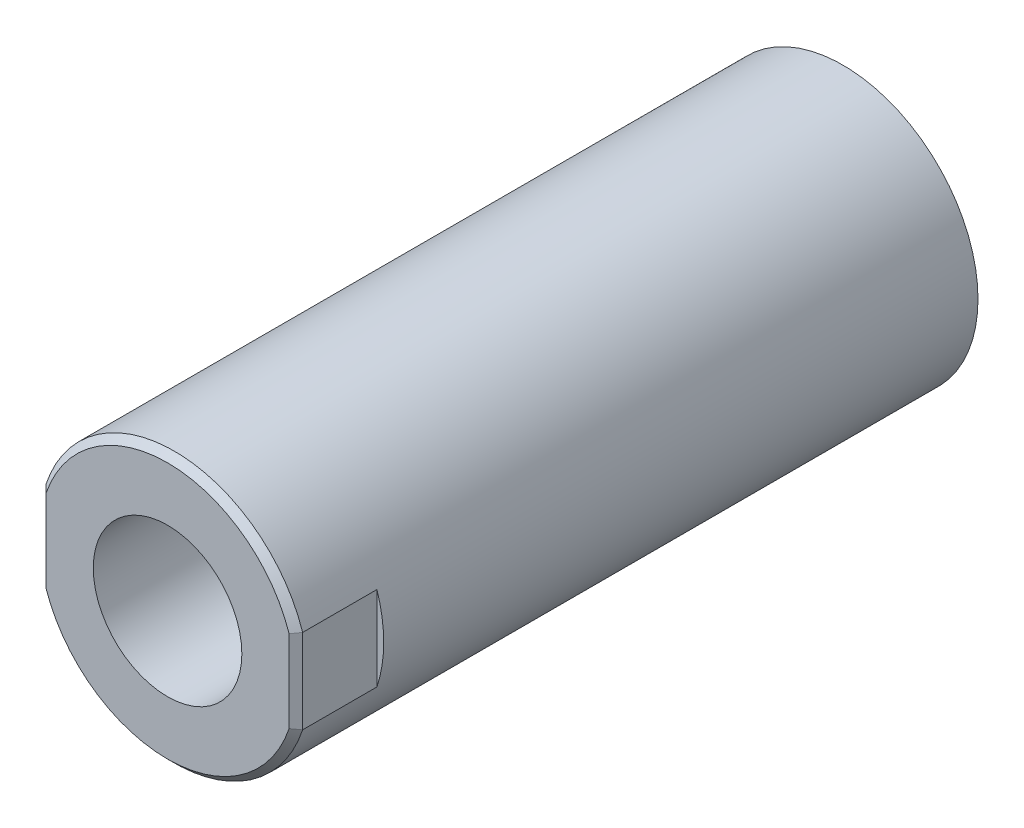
SolidWorks part; units mm, degrees
ref_plane "Front Plane" through (0, 0, 0) normal (0, 0, 1) x (1, 0, 0)
ref_plane "Top Plane" through (0, 0, 0) normal (0, 1, 0) x (1, 0, 0)
ref_plane "Right Plane" through (0, 0, 0) normal (1, 0, 0) x (0, 0, -1)
sketch "Sketch1" plane through (0, 0, 0) normal (0, 0, 1) x (1, 0, 0)
  circle A0 centre (0, 0) radius 20
  dimension "D1" = 40
extrude "S" add sketch "Sketch1" against normal blind 100
sketch "Sketch2" plane through (0, 0, 0) normal (0, 0, 1) x (1, 0, 0)
  circle A0 centre (0, 0) radius 20
  circle A1 centre (0, 0) radius 20 construction
  dimension "D1" = 40
extrude "L2" add sketch "Sketch2" along normal blind 15
hole_wizard "( T1xL4 ) M16x1.25 Tapped Hole1 " positions "3DSketch1" profile "Sketch5" tap size "M24x2.0" standard "Ansi Metric"
sketch3d "3DSketch1"
  circle A0 centre (0, 0, 15) radius 20 construction
  point P0 (0, 0, 15)
  point P5 (0, 0, 35)
sketch "Sketch5" plane through (0, 0, 15) normal (1, 0, 0) x (0, -1, 0)
  line L0 (0, 0) -> (0, 60.6095)
  line L1 (0, 60.6095) -> (11, 54)
  line L2 (11, 54) -> (11, 0)
  line L5 (11, 0) -> (0, 0)
  line L10 (0, 60.6095) -> (-11, 54) construction
  line L11 (0, -6.35) -> (0, 107.95) construction
  dimension "Tap Drill Dia." = 22
  dimension "Tap Drill Depth" = 54
  dimension "Drill Angle" = 118
chamfer "Chamfer2" distance 0.5 angle 45 1 edges at (20, 0, 15)
sketch "Sketch6" plane through (0, 0, 0) normal (0, 0, 1) x (1, 0, 0)
  circle A0 centre (0, 0) radius 19.5
  circle A1 centre (0, 0) radius 20
  circle A2 centre (0, 0) radius 20 construction
  circle A4 centre (0, 0) radius 20 construction
  dimension "D1" = 40
  dimension "D2" = 39
  dimension "D3" = 40
extrude "U/C" cut sketch "Sketch6" along normal blind 1
sketch "Sketch7" plane through (0, 0, 0) normal (0, 1, 0) x (1, 0, 0)
  line L1 (19, 0) -> (21.5, 0)
  line L2 (19, 0) -> (19, 12)
  line L3 (19, 12) -> (21.5, 12)
  line L4 (21.5, 0) -> (21.5, 12)
  line L5 (-21.5, 0) -> (-19, 0)
  line L6 (-21.5, 0) -> (-21.5, 12)
  line L7 (-21.5, 12) -> (-19, 12)
  line L8 (-19, 0) -> (-19, 12)
  line L12 (0, -1) -> (0, -14.5) construction
  line L13 (-20, 100) -> (20, 100) construction
  line L14 (0, 0) -> (0, -15) construction
  line L15 (0, 39) -> (0, -15) construction
  line L16 (-19.5, -15) -> (19.5, -15) construction
  dimension "D1" = 12
  dimension "D2" = 38
  dimension "D3" = 19
  dimension "D4" = 43
  dimension "D5" = 21.5
  dimension "D6" = 40
  dimension "D7" = 15
extrude "A/F" cut sketch "Sketch7" against normal mid plane 21
sketch "Sketch8" plane through (0, 0, 0) normal (0, 1, 0) x (1, 0, 0)
  line L1 (-24.9772, 0) -> (23.7787, 0)
  line L2 (-24.9772, 0) -> (-24.9772, -16.4637)
  line L3 (-24.9772, -16.4637) -> (23.7787, -16.4637)
  line L4 (23.7787, 0) -> (23.7787, -16.4637)
extrude "Cut-Extrude1" cut sketch "Sketch8" against normal mid plane 60
chamfer "Chamfer3" distance 1 angle 45 4 edges at (-19, 0, 0) (0, 20, 0) (0, -20, 0) (19, 0, 0)
equation "\"D2@Sketch6\" =\"D3@Sketch6\" - 1"
equation "\"D1@Sketch6\" = \"D3@Sketch6\""
equation "\"D2@Sketch7\" = \"D6@Sketch7\" - 2"
equation "\"D3@Sketch7\" = \"D2@Sketch7\" / 2"
equation "\"D4@Sketch7\" = \"D2@Sketch7\"+5"
equation "\"D5@Sketch7\" = \"D4@Sketch7\"/2"
equation "\"D1@Sketch7\" = \"D7@Sketch7\"-3"
